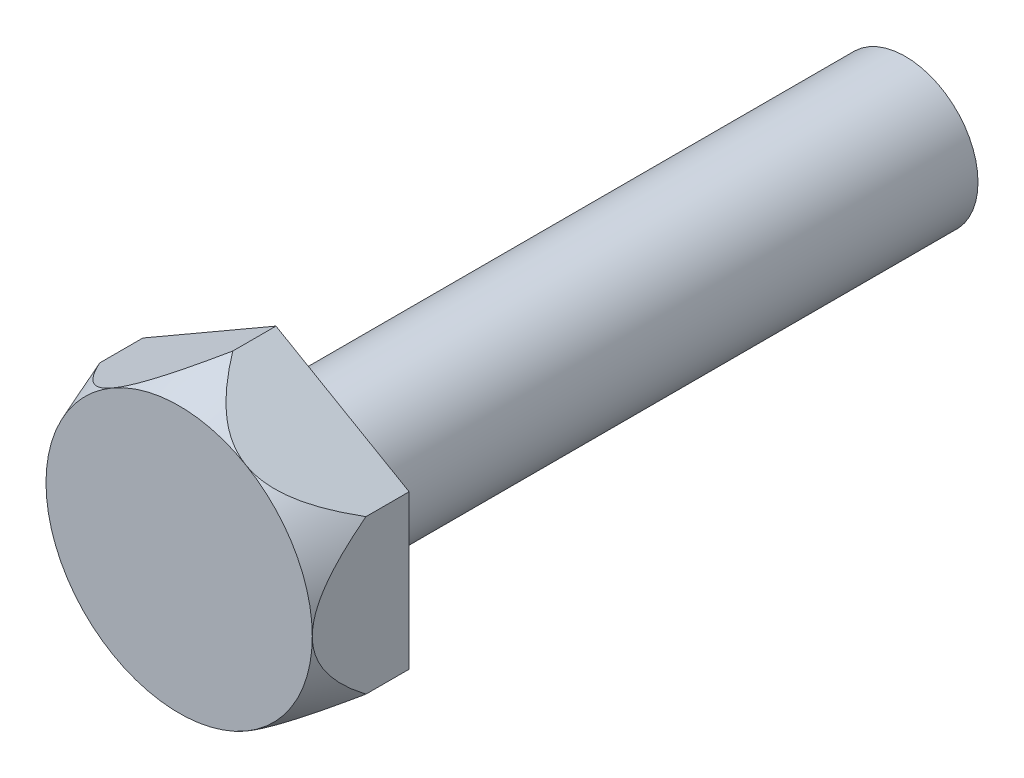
SolidWorks part; units mm, degrees
ref_plane "Front Plane" through (0, 0, 0) normal (0, 0, 1) x (1, 0, 0)
ref_plane "Top Plane" through (0, 0, 0) normal (0, 1, 0) x (1, 0, 0)
ref_plane "Right Plane" through (0, 0, 0) normal (1, 0, 0) x (0, 0, -1)
sketch "Sketch1" plane through (0, 0, 0) normal (0, 0, 1) x (1, 0, 0)
  line L1 (0, 3.1754) -> (-2.75, 1.5877)
  line L2 (-2.75, 1.5877) -> (-2.75, -1.5877)
  line L3 (-2.75, -1.5877) -> (0, -3.1754)
  line L4 (0, -3.1754) -> (2.75, -1.5877)
  line L5 (2.75, -1.5877) -> (2.75, 1.5877)
  line L6 (2.75, 1.5877) -> (0, 3.1754)
  circle A0 centre (0, 0) radius 2.75 construction
extrude "Boss-Extrude1" add sketch "Sketch1" along normal blind 2
sketch "Sketch2" plane through (0, 0, 2) normal (0, 0, 1) x (1, 0, 0)
  circle A0 centre (0, 0) radius 2.75
extrude "Cut-Extrude1" cut sketch "Sketch2" against normal through all draft 21 flip side to cut
sketch "Sketch3" plane through (0, 0, 0) normal (0, 0, -1) x (-1, 0, 0)
  circle A0 centre (0, 0) radius 1.5
extrude "Boss-Extrude2" add sketch "Sketch3" along normal blind 13
